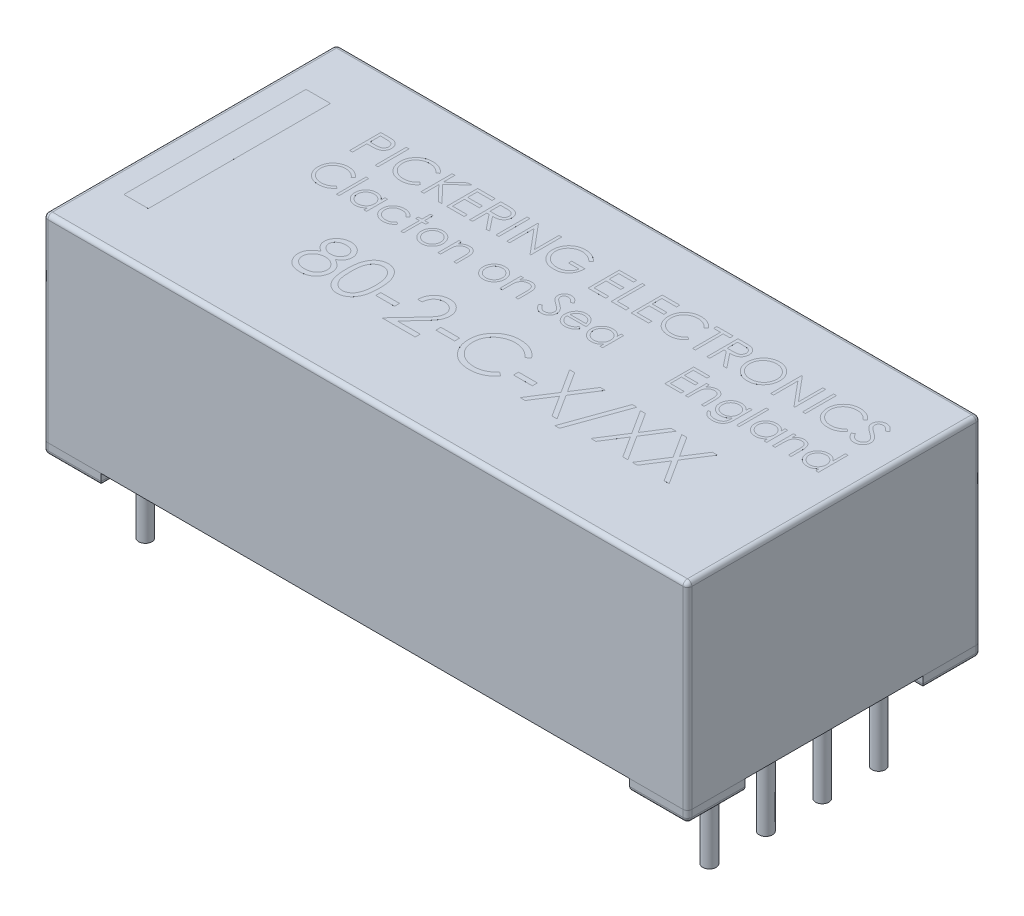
SolidWorks part; units mm, degrees
ref_plane "Front Plane" through (0, 0, 0) normal (0, 0, 1) x (1, 0, 0)
ref_plane "Top Plane" through (0, 0, 0) normal (0, 1, 0) x (1, 0, 0)
ref_plane "Right Plane" through (0, 0, 0) normal (1, 0, 0) x (0, 0, -1)
sketch "Sketch2" plane through (0, 0, 0) normal (0, 1, 0) x (1, 0, 0)
  line L1 (14.5, -6.6) -> (-14.5, -6.6)
  line L2 (14.5, -6.6) -> (14.5, 6.6)
  line L3 (14.5, 6.6) -> (-14.5, 6.6)
  line L4 (-14.5, -6.6) -> (-14.5, 6.6)
  line L5 (14.5, -6.6) -> (-14.5, 6.6) construction
  line L6 (14.5, 6.6) -> (-14.5, -6.6) construction
  point P0 (0, 0)
  dimension "D1" = 13.2
  dimension "D2" = 29
extrude "Main Body" add sketch "Sketch2" along normal blind 8.89 draft 0.023
sketch "Sketch9" plane through (0, 0, 0) normal (0, -1, 0) x (1, 0, 0)
  line L0 (14.5, -6.6) -> (-14.5, -6.6) construction
  line L1 (14.5, 6.6) -> (14.5, -6.6) construction
  circle A0 centre (12.7, -3.81) radius 0.3
  circle A1 centre (12.7, -1.27) radius 0.2963
  circle A2 centre (12.7, 1.27) radius 0.3
  circle A3 centre (12.7, 3.81) radius 0.3
  dimension "D1" = 0.6
  dimension "D5" = 0.6
  dimension "D7" = 0.6
  dimension "D2" = 2.79
  dimension "D3" = 2.54
  dimension "D4" = 1.8
  dimension "D6" = 2.54
  dimension "D8" = 2.54
extrude "Pins" add sketch "Sketch9" along normal blind 4.31
mirror "Mirror2" about plane through (0, 0, 0) normal (1, 0, 0) of "Pins"
sketch "Sketch10" plane through (0, 0, 0) normal (0, -1, 0) x (1, 0, 0)
  line L1 (14.5, 6.6) -> (11.9, 6.6)
  line L2 (14.5, 6.6) -> (14.5, 4)
  line L3 (14.5, 4) -> (11.9, 4)
  line L4 (11.9, 6.6) -> (11.9, 4)
  dimension "D1" = 2.6
  dimension "D2" = 2.6
extrude "Foot" add sketch "Sketch10" along normal blind 0.51
sketch "Sketch11" plane through (0, -0.51, 0) normal (0, -1, 0) x (1, 0, 0)
  line L0 (14.5, 6.6) -> (11.9, 6.6) construction
  line L1 (11.9, 4) -> (13.95, 4)
  line L2 (11.9, 4) -> (11.9, 6.05)
  line L3 (11.9, 6.05) -> (13.95, 6.05)
  line L4 (13.95, 4) -> (13.95, 6.05)
  line L5 (14.5, 4) -> (14.5, 6.6) construction
  dimension "D1" = 0.55
  dimension "D2" = 0.55
extrude "Extrude2" cut sketch "Sketch11" against normal up to surface (0.51 mm away)
mirror "Mirror3" about plane through (0, 0, 0) normal (0, 0, 1) of "Extrude2", "Foot"
mirror "Mirror4" about plane through (0, 0, 0) normal (1, 0, 0) of "Mirror3", "Foot", "Extrude2"
sketch "Sketch12"
  dimension "D1" = 1.1
  dimension "D2" = 8.2
  dimension "D3" = 2.4965
  dimension "D4" = 1.4
  dimension "D5" = 2
  dimension "D6" = 3.8
extrude "Lettering" add sketch "Sketch12" along normal blind 0.0001
fillet "Fillet1" radius 0.2 36 edges at (-14.5, -0.255, -6.6) (14.5, -0.255, -6.6) (14.5, -0.255, 6.6) (-14.5, -0.255, 6.6) (-14.225, -0.51, 4) (-14.5, -0.51, 5.3) (-13.2, -0.51, 6.6) (-11.9, -0.51, 6.325) (-12.925, -0.51, 6.05) (-13.95, -0.51, 5.025) (-11.9, -0.51, -6.325) (-13.2, -0.51, -6.6) (-14.5, -0.51, -5.3) (-14.225, -0.51, -4) (-13.95, -0.51, -5.025) (-12.925, -0.51, -6.05) (11.9, -0.51, 6.325) (13.2, -0.51, 6.6) (14.5, -0.51, 5.3) (14.225, -0.51, 4) (13.95, -0.51, 5.025) (12.925, -0.51, 6.05) (14.225, -0.51, -4) (14.5, -0.51, -5.3) (13.2, -0.51, -6.6) (11.9, -0.51, -6.325) (12.925, -0.51, -6.05) (13.95, -0.51, -5.025) (14.4965, 8.89, 0) (0, 8.89, -6.5965) (-14.4983, 4.445, -6.5983) (14.4983, 4.445, -6.5983) (14.4983, 4.445, 6.5983) (0, 8.89, 6.5965) (-14.4965, 8.89, 0) (-14.4983, 4.445, 6.5983)
